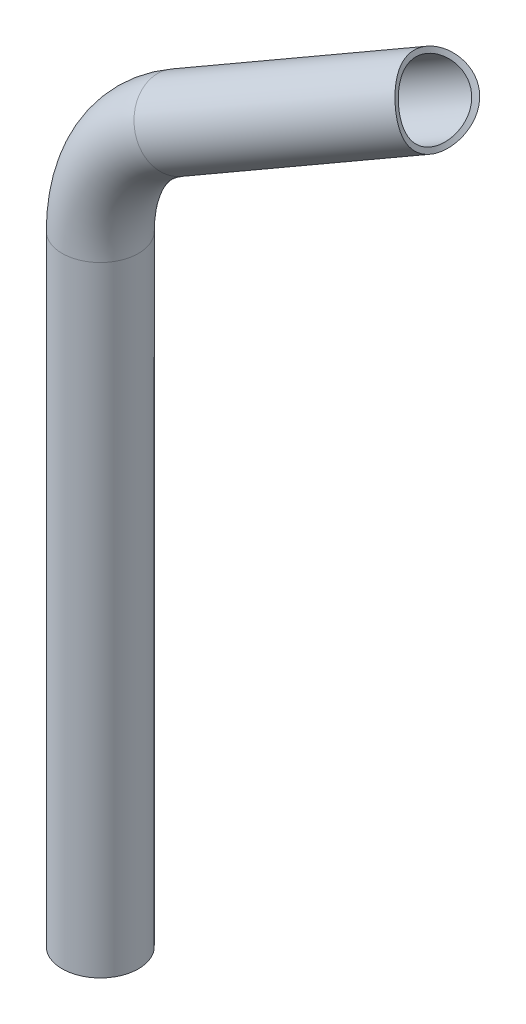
SolidWorks part; units mm, degrees
ref_plane "Plan de face" through (0, 0, 0) normal (0, 0, 1) x (1, 0, 0)
ref_plane "Plan de dessus" through (0, 0, 0) normal (0, 1, 0) x (1, 0, 0)
ref_plane "Plan de droite" through (0, 0, 0) normal (1, 0, 0) x (0, 0, -1)
sketch "Esquisse1" plane through (0, 0, 0) normal (0, 0, 1) x (1, 0, 0)
  line L0 (0, 0) -> (-125, -72.1688)
  line L1 (-155, -124.1303) -> (-155, -367.4893)
  arc A0 (-155, -124.1303) -> (-125, -72.1688) centre (-95, -124.1303) cw
  point P6 (-155, -89.4893)
  dimension "D4" = 60
  dimension "D1" = 155
  dimension "D2" = 278
  dimension "D3" = 120
ref_plane "Plan1" through (-155, -367.4893, 0) normal (0, -1, 0) x (1, 0, 0)
sketch "Esquisse3" plane through (-155, -367.4893, 0) normal (0, -1, 0) x (1, 0, 0)
  circle A0 centre (0, 0) radius 15
  circle A1 centre (0, 0) radius 13
  dimension "D1" = 30
  dimension "D2" = 26
sweep "Balayage6" add profiles "Esquisse3" path "Esquisse1"
sketch "Esquisse4" plane through (53.9345, -118.8659, 41.605) normal (0.3937, -0.8676, 0.3037) x (0.9184, 0.3574, -0.1694)
  circle A0 centre (0, 0) radius 30 construction
  circle A1 centre (0, 0) radius 30
extrude "Enlèv. mat.-Extru.1" cut sketch "Esquisse4" against normal blind 160
